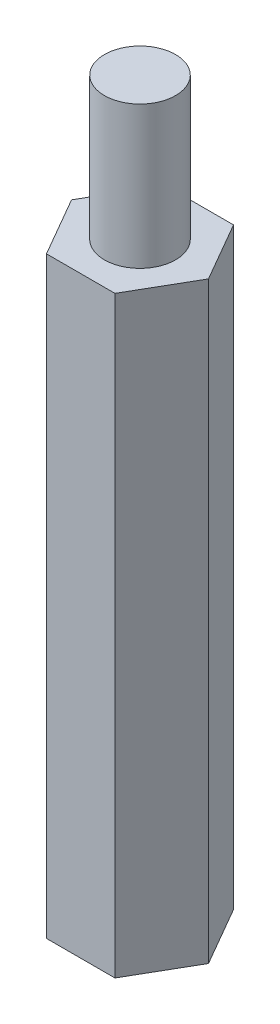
SolidWorks part; units mm, degrees
ref_plane "前视基准面" through (0, 0, 0) normal (0, 0, 1) x (1, 0, 0)
ref_plane "上视基准面" through (0, 0, 0) normal (0, 1, 0) x (1, 0, 0)
ref_plane "右视基准面" through (0, 0, 0) normal (1, 0, 0) x (0, 0, -1)
sketch "草图1" plane through (0, 0, 0) normal (0, 1, 0) x (1, 0, 0)
  line L1 (2.8868, 0) -> (1.4434, 2.5)
  line L2 (1.4434, 2.5) -> (-1.4434, 2.5)
  line L3 (-1.4434, 2.5) -> (-2.8868, 0)
  line L4 (-2.8868, 0) -> (-1.4434, -2.5)
  line L5 (-1.4434, -2.5) -> (1.4434, -2.5)
  line L6 (1.4434, -2.5) -> (2.8868, 0)
  circle A0 centre (0, 0) radius 2.5 construction
  circle A1 centre (0, 0) radius 1.5
  dimension "D1" = 3
  dimension "D2" = 5
extrude "凸台-拉伸1" add sketch "草图1" along normal blind 25
sketch "草图2" plane through (0, 25, 0) normal (0, 1, 0) x (1, 0, 0)
  circle A0 centre (0, 0) radius 1.5 construction
  circle A1 centre (0, 0) radius 1.5
extrude "凸台-拉伸2" add sketch "草图2" along normal blind 6 separate body
